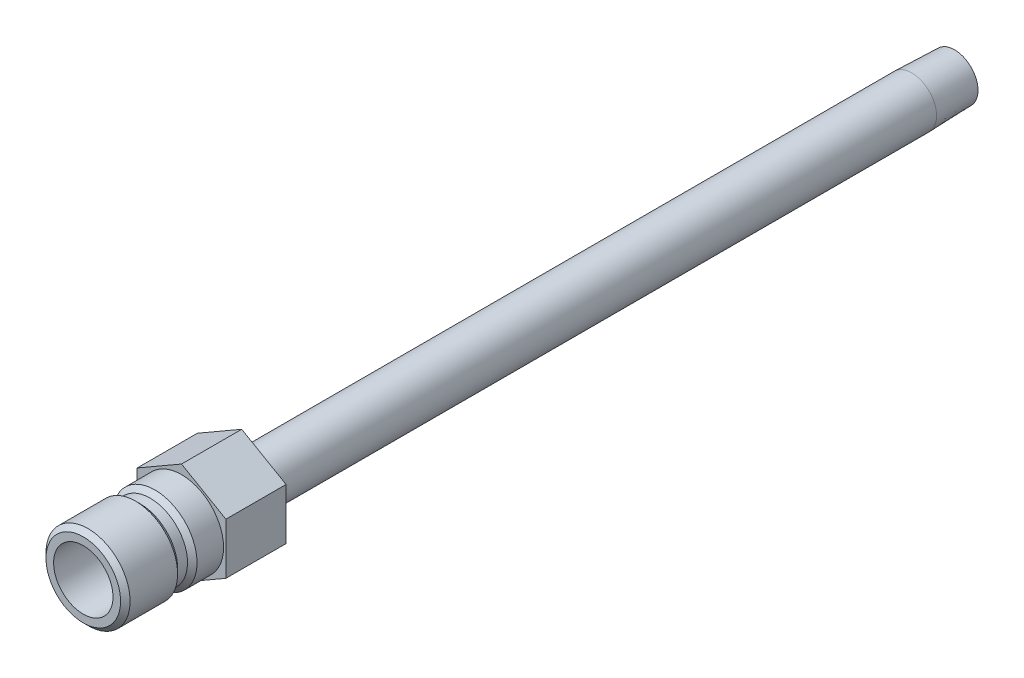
SolidWorks part; units mm, degrees
ref_plane "Front Plane" through (0, 0, 0) normal (0, 0, 1) x (1, 0, 0)
ref_plane "Top Plane" through (0, 0, 0) normal (0, 1, 0) x (1, 0, 0)
ref_plane "Right Plane" through (0, 0, 0) normal (1, 0, 0) x (0, 0, -1)
sketch "Sketch1" plane through (0, 0, 0) normal (1, 0, 0) x (0, 0, -1)
  line L0 (9.652, 0) -> (-18.923, 0) construction
  line L1 (-15.748, 4.7625) -> (-15.748, 5.9817)
  line L2 (-6.604, 5.9817) -> (-6.604, 0) construction
  line L3 (-14.986, 6.7437) -> (-7.366, 6.7437)
  line L4 (0, 6.7437) -> (0, 0) construction
  line L5 (-6.604, 5.9817) -> (-5.0165, 5.9817)
  line L6 (-4.2545, 6.7437) -> (9.652, 6.7437)
  line L7 (9.652, 6.7437) -> (9.652, 3.9688)
  line L8 (-6.604, 5.9817) -> (-7.366, 6.7437)
  line L9 (-5.0165, 5.9817) -> (-4.2545, 6.7437)
  line L10 (-15.748, 5.9817) -> (-14.986, 6.7437)
  line L11 (-3.556, 4.7625) -> (-2.4351, 2.6543)
  line L12 (9.652, 3.9688) -> (117.094, 3.9688)
  line L13 (117.094, 3.9688) -> (123.952, 3.7544)
  line L14 (123.952, 3.7544) -> (123.952, 2.6543)
  line L16 (9.652, 6.731) -> (9.652, 0) construction
  line L19 (-3.556, 4.7625) -> (-15.748, 4.7625)
  line L20 (-2.4351, 2.6543) -> (123.952, 2.6543)
  dimension "D2" = 1.5875
  dimension "D3" = 0.762
  dimension "D4" = 45
  dimension "D5" = 9.144
  dimension "D6" = 45
  dimension "D7" = 1.79
  dimension "D8" = 6.858
  dimension "D9" = 139.7
  dimension "D10" = 3.175
  dimension "D11" = 9.525
  dimension "D12" = 7.9375
  dimension "D13" = 25.4
  dimension "D14" = 13.4874
  dimension "D15" = 5.3086
  dimension "D16" = 9.652
  dimension "D17" = 118
  dimension "D18" = 12.192
revolve "Revolve1" add sketch "Sketch1" angle 360 about L0
sketch "Sketch2" plane through (0, 0, 0) normal (0, 0, 1) x (1, 0, 0)
  line L1 (-7.112, 4.1061) -> (-7.112, -4.1061)
  line L2 (-7.112, -4.1061) -> (0, -8.2122)
  line L3 (0, -8.2122) -> (7.112, -4.1061)
  line L4 (7.112, -4.1061) -> (7.112, 4.1061)
  line L5 (7.112, 4.1061) -> (0, 8.2122)
  line L6 (0, 8.2122) -> (-7.112, 4.1061)
  circle A0 centre (0, 0) radius 7.112 construction
  circle A2 centre (0, 0) radius 2.6543
  circle A3 centre (0, 0) radius 2.6543 construction
  dimension "D1" = 14.224
extrude "Boss-Extrude1" add sketch "Sketch2" against normal up to vertex (9.652 mm away)
